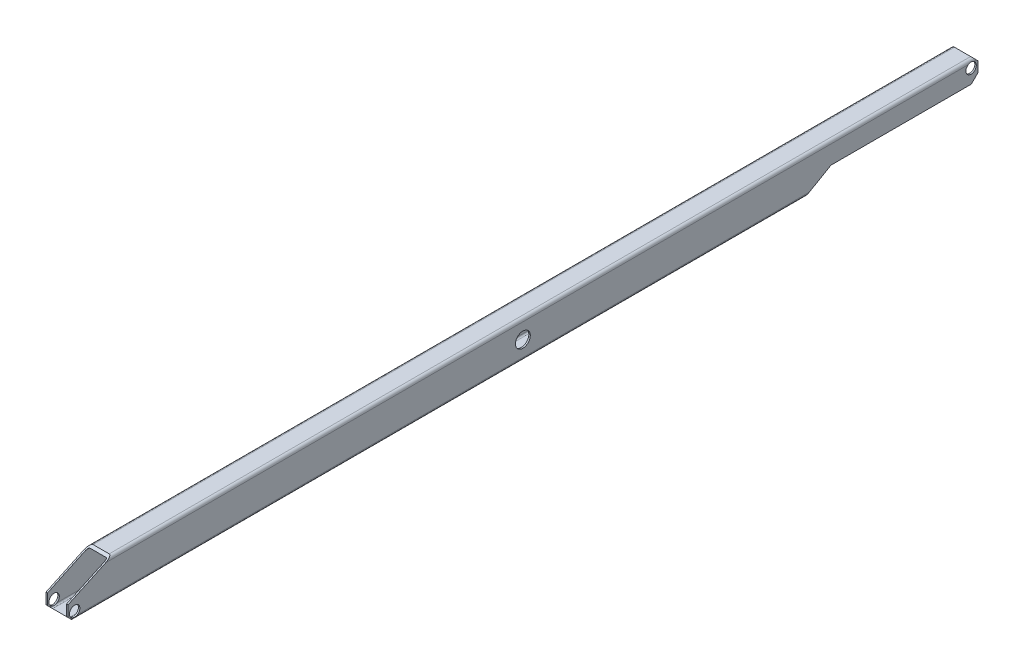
SolidWorks part; units mm, degrees
ref_plane "Plan de face" through (0, 0, 0) normal (0, 0, 1) x (1, 0, 0)
ref_plane "Plan de dessus" through (0, 0, 0) normal (0, 1, 0) x (1, 0, 0)
ref_plane "Plan de droite" through (0, 0, 0) normal (1, 0, 0) x (0, 0, -1)
sketch "Esquisse1" plane through (0, 0, 0) normal (0, 0, 1) x (1, 0, 0)
  line L0 (20, 0) -> (130, 0)
  line L1 (150, 20) -> (150, 230)
  line L2 (130, 250) -> (20, 250)
  line L3 (0, 230) -> (0, 20)
  line L4 (130, 240) -> (20, 240)
  line L5 (10, 230) -> (10, 20)
  line L6 (20, 10) -> (130, 10)
  line L7 (140, 20) -> (140, 230)
  arc A0 (130, 0) -> (150, 20) centre (130, 20) ccw
  arc A1 (150, 230) -> (130, 250) centre (130, 230) ccw
  arc A2 (20, 250) -> (0, 230) centre (20, 230) ccw
  arc A3 (0, 20) -> (20, 0) centre (20, 20) ccw
  arc A4 (20, 240) -> (10, 230) centre (20, 230) ccw
  arc A5 (10, 20) -> (20, 10) centre (20, 20) ccw
  arc A6 (130, 10) -> (140, 20) centre (130, 20) ccw
  arc A7 (140, 230) -> (130, 240) centre (130, 230) ccw
  dimension "D3" = 20
  dimension "D1" = 150
  dimension "D2" = 250
  dimension "D4" = 10
extrude "Extrusion1" add sketch "Esquisse1" along normal mid plane 6190
chamfer "Chanfrein1" distance 30 angle 45 1 edges at (75, 250, -3095)
chamfer "Chanfrein2" distance 35 angle 45 1 edges at (75, 0, 3095)
sketch "Esquisse4" plane through (150, 0, 0) normal (1, 0, 0) x (0, 0, -1)
  line L0 (-3060, 0) -> (3095, 0) construction
  line L1 (-3095, 35) -> (-3095, 230) construction
  circle A0 centre (-3050, 50) radius 35.5
  dimension "D2" = 45
  dimension "D3" = 71
  dimension "D1" = 50
extrude "Enlèv. mat.-Extru.3" cut sketch "Esquisse4" against normal up to surface (150 mm away)
sketch "Esquisse2" plane through (150, 0, 0) normal (1, 0, 0) x (0, 0, -1)
  line L1 (-3095, 250) -> (3065, 250) construction
  circle A0 centre (3048, 200) radius 35.5
  arc A2 (-3031.0197, 20) -> (-3068.9803, 20) centre (-3050, 50) ccw construction
  dimension "D3" = 71
  dimension "D1" = 6098
  dimension "D2" = 50
extrude "Enlèv. mat.-Extru.1" cut sketch "Esquisse2" against normal up to surface (150 mm away)
sketch "Esquisse3" plane through (150, 0, 0) normal (1, 0, 0) x (0, 0, -1)
  line L0 (-3095, 250) -> (3065, 250) construction
  circle A0 centre (-1.0777, 125) radius 50.5
  arc A1 (3029.0197, 230) -> (3066.9803, 230) centre (3048, 200) ccw construction
  dimension "D2" = 101
  dimension "D3" = 3050
  dimension "D1" = 125
extrude "Enlèv. mat.-Extru.2" cut sketch "Esquisse3" against normal up to surface (150 mm away)
chamfer "Chanfrein3" distance 150 angle 45 1 edges at (75, 0, -3095)
sketch "Esquisse5" plane through (0, 0, 0) normal (-1, 0, 0) x (0, 0, 1)
  line L0 (3095, 250) -> (-3065, 250) construction
  line L1 (-3184.7548, 105) -> (-2095, 105)
  line L2 (-3184.7548, 105) -> (-3184.7548, -87.4042)
  line L3 (-3095, 220) -> (-3095, 150) construction
  line L6 (-2095, 105) -> (-1761.746, -87.4042)
  line L7 (3060, 0) -> (-2945, 0) construction
  line L8 (-1761.746, -87.4042) -> (-3184.7548, -87.4042)
  dimension "D1" = 145
  dimension "D2" = 1000
  dimension "D3" = 30
extrude "Enlèv. mat.-Extru.4" cut sketch "Esquisse5" against normal blind 180
sketch "Esquisse6" plane through (0, 0, 0) normal (-1, 0, 0) x (0, 0, 1)
  line L0 (3095, 110) -> (2795, 250)
  line L1 (3095, 230) -> (3095, 35) construction
  line L2 (3095, 250) -> (-3065, 250) construction
  line L3 (2795, 250) -> (3095, 250)
  line L4 (3095, 250) -> (3095, 110)
  line L5 (3095, 110) -> (2997.6729, 110)
  dimension "D1" = 140
  dimension "D2" = 300
extrude "Enlèv. mat.-Extru.5" cut sketch "Esquisse6" against normal blind 190 contours L0 M9 M10
